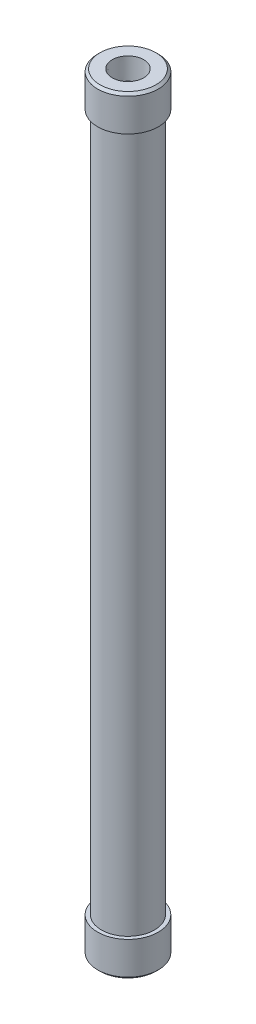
SolidWorks part; units mm, degrees
ref_plane "Front Plane" through (0, 0, 0) normal (0, 0, 1) x (1, 0, 0)
ref_plane "Top Plane" through (0, 0, 0) normal (0, 1, 0) x (1, 0, 0)
ref_plane "Right Plane" through (0, 0, 0) normal (1, 0, 0) x (0, 0, -1)
sketch "Sketch1" plane through (0, 0, 0) normal (0, 1, 0) x (1, 0, 0)
  circle A0 centre (0, 0) radius 16.7005
  circle A1 centre (0, 0) radius 13.1445
  dimension "D1" = 33.401
  dimension "D2" = 3.556
extrude "Boss-Extrude1" add sketch "Sketch1" along normal blind 482.6
sketch "Sketch2" plane through (0, 0, 0) normal (0, 1, 0) x (1, 0, 0)
  circle A0 centre (0, 0) radius 19.05
  dimension "D1" = 38.1
extrude "Boss-Extrude2" add sketch "Sketch2" along normal blind 22.098
ref_plane "Plane1" through (0, 482.6, 0) normal (0, 1, 0) x (1, 0, 0)
sketch "Sketch3" plane through (0, 482.6, 0) normal (0, 1, 0) x (1, 0, 0)
  circle A0 centre (0, 0) radius 19.05
  dimension "D1" = 38.1
extrude "Boss-Extrude3" add sketch "Sketch3" against normal blind 22.098
hole_wizard "1/2 NPT Tapped Hole1" positions "Sketch6" profile "Sketch5" size "1/2" standard "ANSI Inch"
sketch "Sketch6" plane through (0, 0, 0) normal (0, -1, 0) x (-1, 0, 0)
  point P0 (0, 0)
sketch "Sketch5" plane through (0, 0, 0) normal (1, 0, 0) x (0, 0, -1)
  line L0 (0, 0) -> (0, 27.9705)
  line L1 (8.9281, 22.606) -> (0, 27.9705)
  line L2 (-8.9281, 22.606) -> (0, 27.9705) construction
  line L3 (8.9281, 22.606) -> (8.9281, 13.462)
  line L4 (8.9281, 13.462) -> (9.4797, 13.462)
  line L5 (9.4797, 13.462) -> (9.8828, 0)
  line L6 (-9.4797, 13.462) -> (-9.8828, 0) construction
  line L7 (9.8828, 0) -> (0, 0)
  line L8 (0, -6.35) -> (0, 107.95) construction
  line L11 (-8.9281, 13.462) -> (-9.4797, 13.462) construction
  dimension "Tap Drill Dia." = 17.8562
  dimension "Tap Drill Depth" = 22.606
  dimension "Thread Dia." = 19.7656
  dimension "Thread Angle" = 3.43
  dimension "Thread Depth" = 13.462
  dimension "Drill Angle" = 118
hole_wizard "1/2 NPT Tapped Hole2" positions "Sketch8" profile "Sketch7" size "1/2" standard "ANSI Inch"
sketch "Sketch8" plane through (0, 482.6, 0) normal (0, 1, 0) x (1, 0, 0)
  point P0 (0, 0)
sketch "Sketch7" plane through (0, 482.6, 0) normal (1, 0, 0) x (0, 0, 1)
  line L0 (0, 0) -> (0, 27.9705)
  line L1 (8.9281, 22.606) -> (0, 27.9705)
  line L2 (-8.9281, 22.606) -> (0, 27.9705) construction
  line L3 (8.9281, 22.606) -> (8.9281, 13.462)
  line L4 (8.9281, 13.462) -> (9.4797, 13.462)
  line L5 (9.4797, 13.462) -> (9.8828, 0)
  line L6 (-9.4797, 13.462) -> (-9.8828, 0) construction
  line L7 (9.8828, 0) -> (0, 0)
  line L8 (0, -6.35) -> (0, 107.95) construction
  line L11 (-8.9281, 13.462) -> (-9.4797, 13.462) construction
  dimension "Tap Drill Dia." = 17.8562
  dimension "Tap Drill Depth" = 22.606
  dimension "Thread Dia." = 19.7656
  dimension "Thread Angle" = 3.43
  dimension "Thread Depth" = 13.462
  dimension "Drill Angle" = 118
chamfer "Chamfer2" distance 1.524 angle 45 2 edges at (0, 0, 19.05) (0, 482.6, 19.05)
